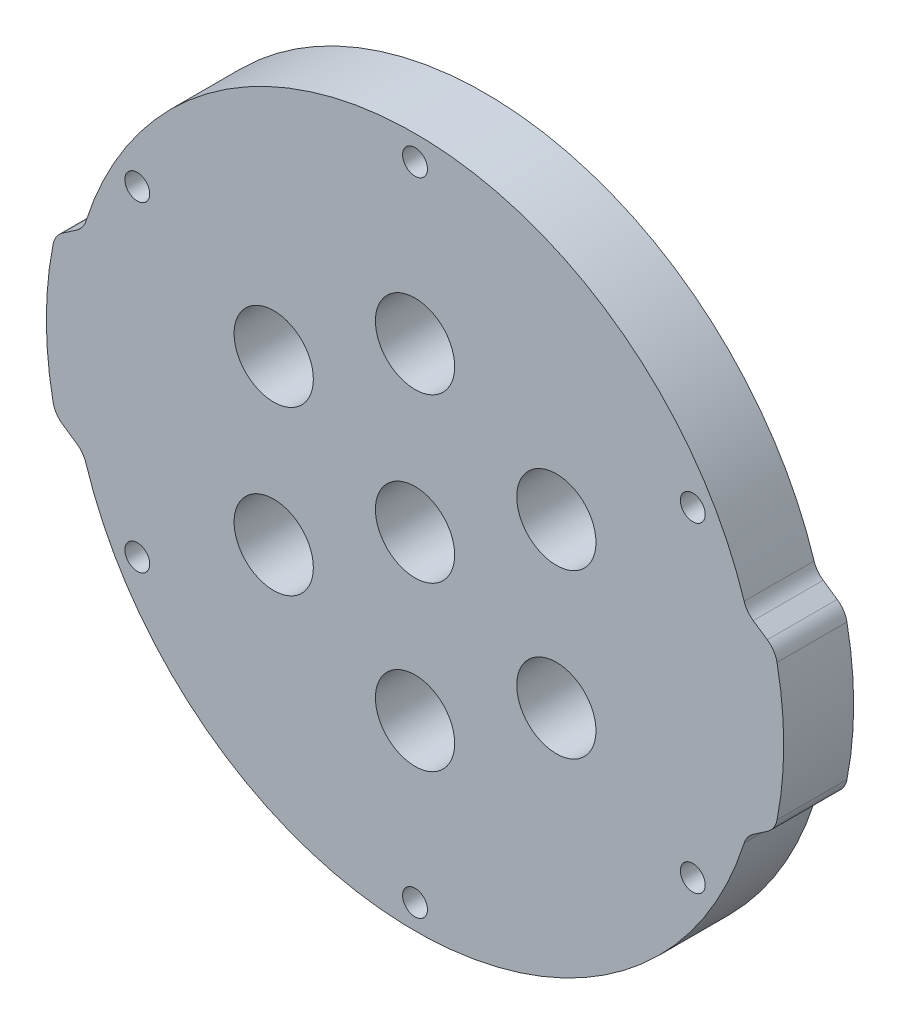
SolidWorks part; units mm, degrees
other "<WTE3-P-END-CAP-7-HOLE-R1>-<Cut-Extrude1>"
ref_plane "Front Plane" through (0, 0, 0) normal (0, 0, 1) x (1, 0, 0)
ref_plane "Top Plane" through (0, 0, 0) normal (0, 1, 0) x (1, 0, 0)
ref_plane "Right Plane" through (0, 0, 0) normal (1, 0, 0) x (0, 0, -1)
inserted part "WTE3-P-END-CAP-7-HOLE-R1"
